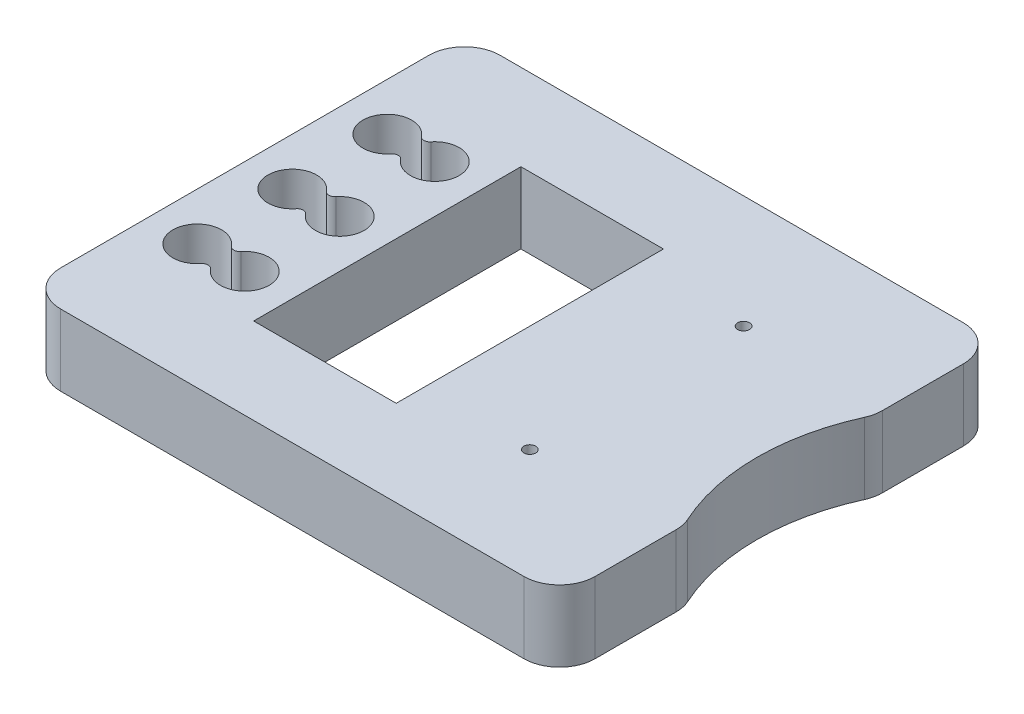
SolidWorks part; units mm, degrees
ref_plane "Plan de face" through (0, 0, 0) normal (0, 0, 1) x (1, 0, 0)
ref_plane "Plan de dessus" through (0, 0, 0) normal (0, 1, 0) x (1, 0, 0)
ref_plane "Plan de droite" through (0, 0, 0) normal (1, 0, 0) x (0, 0, -1)
sketch "Esquisse1" plane through (0, 0, 0) normal (0, 1, 0) x (1, 0, 0)
  line L0 (0, 18.5) -> (45, 18.5) construction
  line L1 (0, 0) -> (45, 0)
  line L2 (0, 0) -> (0, 37)
  line L3 (0, 37) -> (45, 37)
  line L4 (45, 0) -> (45, 37)
  line L5 (0, 22.5) -> (13.3727, 22.5) construction
  line L6 (-566.3042, -264.8279) -> (100.3624, -264.8279) construction
  line L8 (12, 29.75) -> (24, 29.75)
  line L9 (12, 29.75) -> (12, 7.25)
  line L10 (12, 7.25) -> (24, 7.25)
  line L11 (24, 29.75) -> (24, 7.25)
  arc A0 (6, 18.95) -> (6, 18.05) centre (4, 18.5) ccw
  arc A1 (6, 18.05) -> (6, 18.95) centre (8, 18.5) ccw
  arc A2 (6, 26.95) -> (6, 26.05) centre (8, 26.5) cw
  arc A3 (6, 26.05) -> (6, 26.95) centre (4, 26.5) cw
  arc A4 (6, 10.95) -> (6, 10.05) centre (4, 10.5) ccw
  arc A5 (6, 10.05) -> (6, 10.95) centre (8, 10.5) ccw
  circle A6 centre (33, 27.5) radius 0.5
  arc A7 (45, 26.5) -> (45, 10.5) centre (61.1245, 18.5) ccw
  circle A8 centre (33, 9.5) radius 0.5
  dimension "D1" = 4.1
  dimension "D3" = 4.1
  dimension "D8" = 1
  dimension "D11" = 16
  dimension "D12" = 18
  dimension "D2" = 4
  dimension "D4" = 4
  dimension "D5" = 4
  dimension "D6" = 37
  dimension "D7" = 45
  dimension "D9" = 9
  dimension "D10" = 33
  dimension "D13" = 12
  dimension "D14" = 22.5
  dimension "D15" = 12
extrude "Boss.-Extru.1" add sketch "Esquisse1" along normal blind 6 contours A7 L4 L3 L2 L1 A6 A5 A4 A1 A0 L8 L11 L10 L9 A2 A3
fillet "Congé1" radius 3 6 edges at (0, 3, -37) (0, 3, 0) (45, 3, -37) (45, 3, -26.5) (45, 3, -10.5) (45, 3, 0)
fillet "Congé2" radius 0.5 6 edges at (6, 3, -10.05) (6, 3, -10.95) (6, 3, -18.05) (6, 3, -18.95) (6, 3, -26.95) (6, 3, -26.05)
ref_plane "Plan1" through (0, 0, -18.5) normal (0, 0, 1) x (1, 0, 0)
ref_plane "Plan2" through (18, 0, 0) normal (1, 0, 0) x (0, 0, -1)
